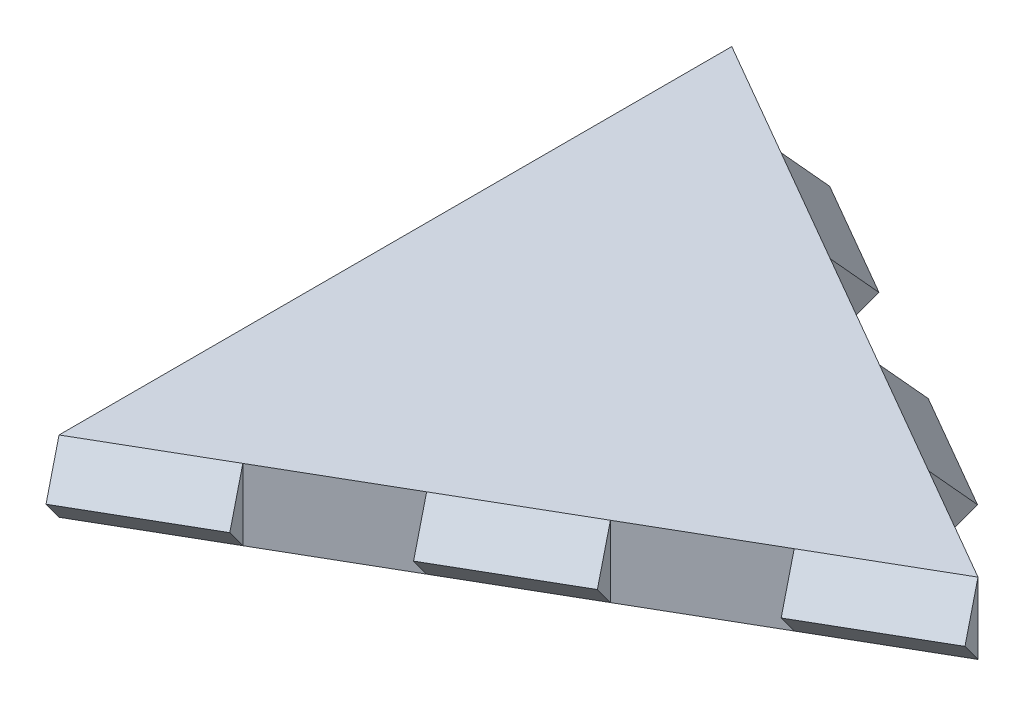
SolidWorks part; units mm, degrees
ref_plane "Alzado" through (0, 0, 0) normal (0, 0, 1) x (1, 0, 0)
ref_plane "Planta" through (0, 0, 0) normal (0, 1, 0) x (1, 0, 0)
ref_plane "Vista lateral" through (0, 0, 0) normal (1, 0, 0) x (0, 0, -1)
sketch "Croquis1" plane through (0, 0, 0) normal (0, 1, 0) x (1, 0, 0)
  line L1 (23.094, 0) -> (-11.547, 20)
  line L2 (-11.547, 20) -> (-11.547, -20)
  line L3 (-11.547, -20) -> (23.094, 0)
  circle A0 centre (0, 0) radius 11.547 construction
  dimension "D1" = 40
extrude "Saliente-Extruir1" add sketch "Croquis1" along normal blind 4.24
sketch "Croquis4" plane through (5.7735, 0, 10) normal (0.5, 0, 0.866) x (0.866, 0, -0.5)
  line L1 (-20, 4.24) -> (20, 4.24)
  line L2 (-20, 4.24) -> (-20, 0)
  line L3 (-20, 0) -> (20, 0)
  line L4 (20, 4.24) -> (20, 0)
extrude "Saliente-Extruir2" add sketch "Croquis4" along normal blind 4.24
sketch "Croquis5" plane through (0, 4.24, 0) normal (0, 1, 0) x (1, 0, 0)
  line L1 (25.214, -3.6719) -> (-9.427, -23.6719) construction
  line L2 (11.3576, -11.6719) -> (9.2376, -8)
  line L3 (9.2376, -8) -> (16.1658, -4)
  line L4 (16.1658, -4) -> (18.2858, -7.6719)
  line L5 (18.2858, -7.6719) -> (11.3576, -11.6719)
  line L6 (4.4294, -15.6719) -> (2.3094, -12)
  line L7 (2.3094, -12) -> (-4.6188, -16)
  line L8 (-4.6188, -16) -> (-2.4988, -19.6719)
  line L9 (-2.4988, -19.6719) -> (4.4294, -15.6719)
extrude "Cortar-Extruir1" cut sketch "Croquis5" against normal blind 4.24
sketch "Croquis6" plane through (-17.3205, 0, 10) normal (-0.866, 0, 0.5) x (0.5, 0, 0.866)
  line L0 (11.547, 4.24) -> (13.667, 2.12)
  line L1 (11.547, 0) -> (13.667, 2.12)
  line L2 (11.547, 4.24) -> (15.787, 4.24)
  line L3 (15.787, 4.24) -> (15.787, 0)
  line L4 (11.547, 0) -> (15.787, 0)
extrude "Cortar-Extruir2" cut sketch "Croquis6" against normal blind 54.24
sketch "Croquis7" plane through (-11.547, 0, 0) normal (-1, 0, 0) x (0, 0, 1)
  line L1 (-20, 0) -> (20, 0)
  line L2 (-20, 0) -> (-20, 4.24)
  line L3 (-20, 4.24) -> (20, 4.24)
  line L4 (20, 0) -> (20, 4.24)
extrude "Saliente-Extruir3" add sketch "Croquis7" along normal blind 4.24
sketch "Croquis8" plane through (0, 4.24, 0) normal (0, 1, 0) x (1, 0, 0)
  line L0 (-11.547, 4) -> (-11.547, -4)
  line L1 (-15.787, -20) -> (-15.787, 20) construction
  line L2 (-15.787, 4) -> (-11.547, 4)
  line L3 (-15.787, 4) -> (-15.787, -4)
  line L4 (-11.547, 12) -> (-15.787, 12)
  line L5 (-15.787, 12) -> (-15.787, 20)
  line L6 (-15.787, 20) -> (-11.547, 20)
  line L7 (-11.547, 20) -> (-11.547, 12)
  line L9 (-15.787, -4) -> (-11.547, -4)
  line L11 (-11.547, -12) -> (-15.787, -12)
  line L12 (-15.787, -12) -> (-15.787, -20)
  line L13 (-15.787, -20) -> (-11.547, -20)
  line L14 (-11.547, -20) -> (-11.547, -12)
extrude "Cortar-Extruir3" cut sketch "Croquis8" against normal blind 4.24
sketch "Croquis9" plane through (0, 0, 12) normal (0, 0, 1) x (1, 0, 0)
  line L0 (-11.547, 4.24) -> (-13.667, 2.12)
  line L1 (-15.787, 0) -> (-15.787, 4.24)
  line L2 (-13.667, 2.12) -> (-11.547, 0)
  line L3 (-11.547, 0) -> (-15.787, 0)
  line L4 (-15.787, 4.24) -> (-11.547, 4.24)
extrude "Cortar-Extruir4" cut sketch "Croquis9" against normal blind 34.24
sketch "Croquis10" plane through (5.7735, 0, -10) normal (0.5, 0, -0.866) x (-0.866, 0, -0.5)
  line L1 (-20, 0) -> (20, 0)
  line L2 (-20, 0) -> (-20, 4.24)
  line L3 (-20, 4.24) -> (20, 4.24)
  line L4 (20, 0) -> (20, 4.24)
extrude "Saliente-Extruir4" add sketch "Croquis10" along normal blind 4.24
sketch "Croquis11" plane through (0, 4.24, 0) normal (0, 1, 0) x (1, 0, 0)
  line L0 (7.8935, 13.6719) -> (11.3576, 11.6719)
  line L1 (-9.427, 23.6719) -> (25.214, 3.6719) construction
  line L2 (11.3576, 11.6719) -> (9.2376, 8)
  line L4 (16.1658, 4) -> (18.2858, 7.6719)
  line L5 (18.2858, 7.6719) -> (25.214, 3.6719)
  line L6 (25.214, 3.6719) -> (23.094, 0)
  line L7 (23.094, 0) -> (16.1658, 4)
  line L8 (7.8935, 13.6719) -> (4.4294, 15.6719)
  line L9 (4.4294, 15.6719) -> (2.3094, 12)
  line L11 (-4.6188, 16) -> (-2.4988, 19.6719)
  line L12 (-2.4988, 19.6719) -> (-9.427, 23.6719)
  line L13 (-9.427, 23.6719) -> (-11.547, 20)
  line L14 (-9.427, 23.6719) -> (-11.547, 20) construction
  line L15 (-11.547, 20) -> (-4.6188, 16)
  line L16 (2.3094, 12) -> (9.2376, 8)
extrude "Cortar-Extruir5" cut sketch "Croquis11" against normal blind 4.24
sketch "Croquis12" plane through (10.3923, 0, 6) normal (0.866, 0, 0.5) x (0.5, 0, -0.866)
  line L0 (11.547, 4.24) -> (13.667, 2.12)
  line L1 (15.787, 0) -> (15.787, 4.24)
  line L2 (13.667, 2.12) -> (11.547, 0)
  line L3 (11.547, 0) -> (15.787, 0)
  line L4 (11.547, 4.24) -> (15.787, 4.24)
extrude "Cortar-Extruir6" cut sketch "Croquis12" against normal blind 44.24
